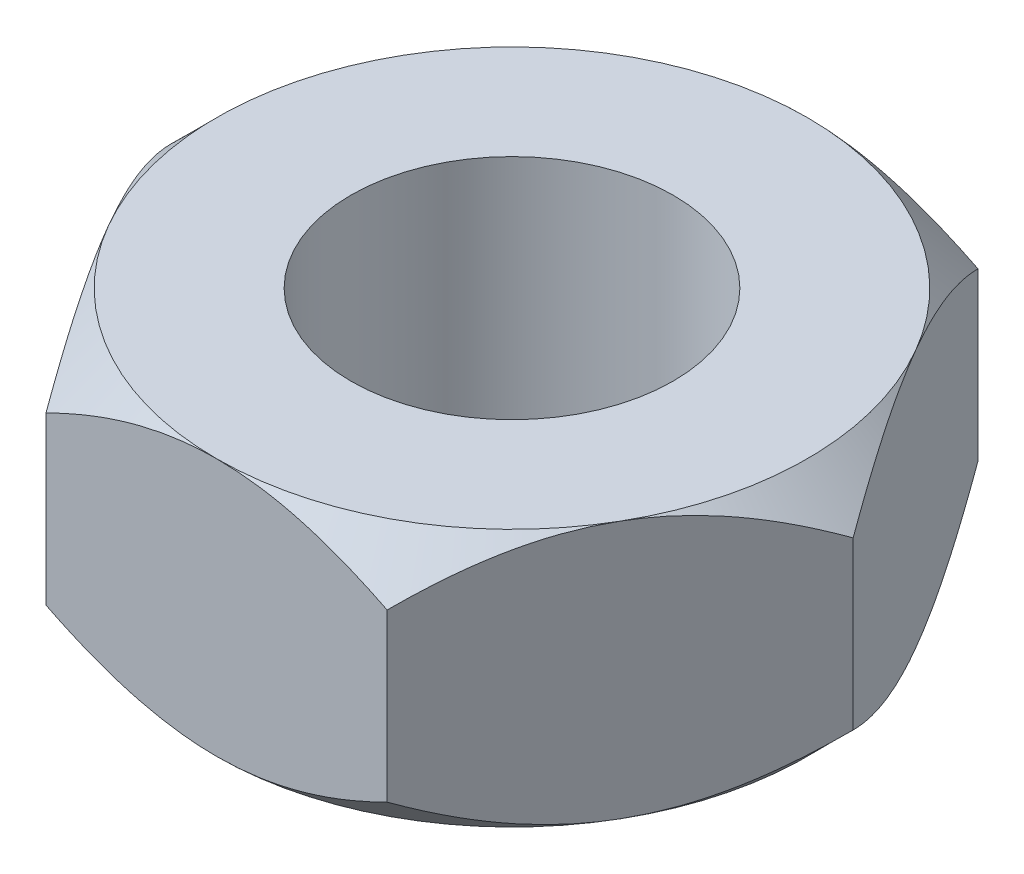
SolidWorks part; units mm, degrees
ref_plane "Plan de face" through (0, 0, 0) normal (0, 0, 1) x (1, 0, 0)
ref_plane "Plan de dessus" through (0, 0, 0) normal (0, 1, 0) x (1, 0, 0)
ref_plane "Plan de droite" through (0, 0, 0) normal (1, 0, 0) x (0, 0, -1)
sketch "Esquisse1" plane through (0, 0, 0) normal (0, 1, 0) x (1, 0, 0)
  line L1 (3.1754, 0) -> (1.5877, 2.75)
  line L2 (1.5877, 2.75) -> (-1.5877, 2.75)
  line L3 (-1.5877, 2.75) -> (-3.1754, 0)
  line L4 (-3.1754, 0) -> (-1.5877, -2.75)
  line L5 (-1.5877, -2.75) -> (1.5877, -2.75)
  line L6 (1.5877, -2.75) -> (3.1754, 0)
  circle A0 centre (0, 0) radius 2.75 construction
extrude "Extrusion1" add sketch "Esquisse1" along normal blind 2.4
sketch "Esquisse3" plane through (0, 2.4, 0) normal (0, 1, 0) x (1, 0, 0)
  circle A0 centre (0, 0) radius 1.5
extrude "Enlèv. mat.-Extru.1" cut sketch "Esquisse3" against normal up to next
sketch "Esquisse4" plane through (0, 0, 0) normal (0, 0, 1) x (1, 0, 0)
  line L0 (0, 0) -> (-2.75, 0)
  line L1 (-3.1754, 0) -> (-1.5877, 0) construction
  line L2 (-2.75, 0) -> (-3.1754, 0.4254)
  line L3 (-3.1754, 2.4) -> (-3.1754, 0) construction
  line L4 (-3.1754, 0.4254) -> (-3.1754, 1.9746)
  line L5 (-3.1754, 1.9746) -> (-2.75, 2.4)
  line L6 (-3.1754, 2.4) -> (-1.5877, 2.4) construction
  line L7 (-2.75, 2.4) -> (0, 2.4)
  line L8 (-1.5877, 2.4) -> (1.5877, 2.4) construction
  line L9 (0, 2.4) -> (0, 0) construction
  line L10 (0, 0) -> (0, 2.4) construction
other "Enlèv. de mat.-Révol.-Mince4" parameters "D1"=360, "D3"=5, "D4"=1, "D7"=0
